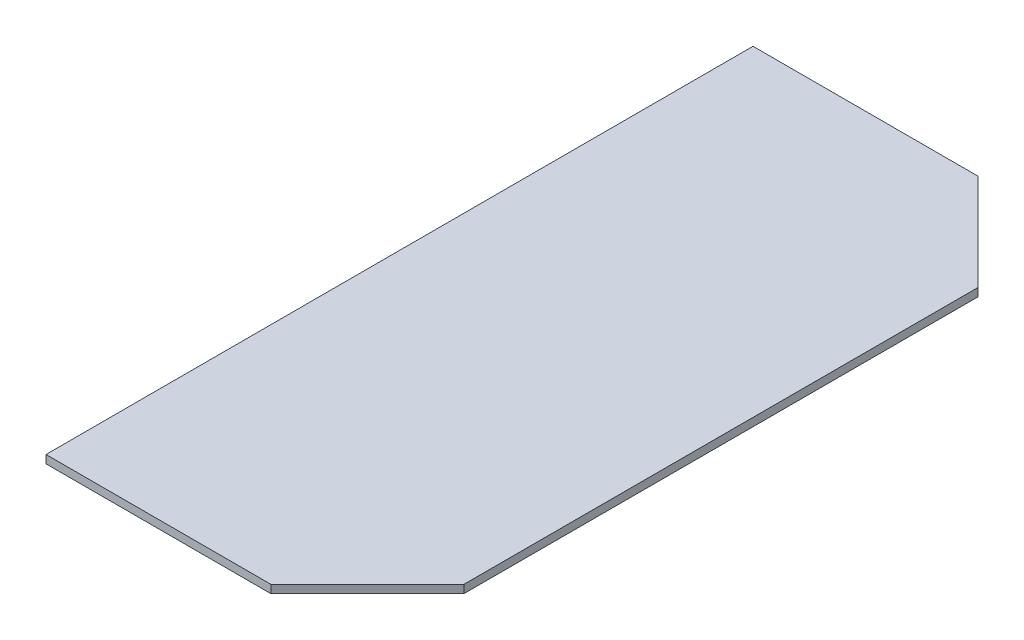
SolidWorks part; units mm, degrees
ref_plane "Front Plane" through (0, 0, 0) normal (0, 0, 1) x (1, 0, 0)
ref_plane "Top Plane" through (0, 0, 0) normal (0, 1, 0) x (1, 0, 0)
ref_plane "Right Plane" through (0, 0, 0) normal (1, 0, 0) x (0, 0, -1)
sketch "Sketch1" plane through (0, 0, 0) normal (0, 1, 0) x (1, 0, 0)
  line L0 (0, 69.85) -> (0, -69.85)
  line L1 (0, 69.85) -> (44.45, 69.85)
  line L2 (44.45, 69.85) -> (63.5, 50.8)
  line L3 (63.5, 50.8) -> (63.5, -50.8)
  line L4 (0, 0) -> (59.5147, 0) construction
  line L5 (44.45, -69.85) -> (63.5, -50.8)
  line L6 (0, -69.85) -> (44.45, -69.85)
  point P9 (63.5, 0)
  dimension "D1" = 45
  dimension "D2" = 139.7
  dimension "D3" = 63.5
  dimension "D4" = 101.6
extrude "Boss-Extrude1" add sketch "Sketch1" along normal blind 1.6002
